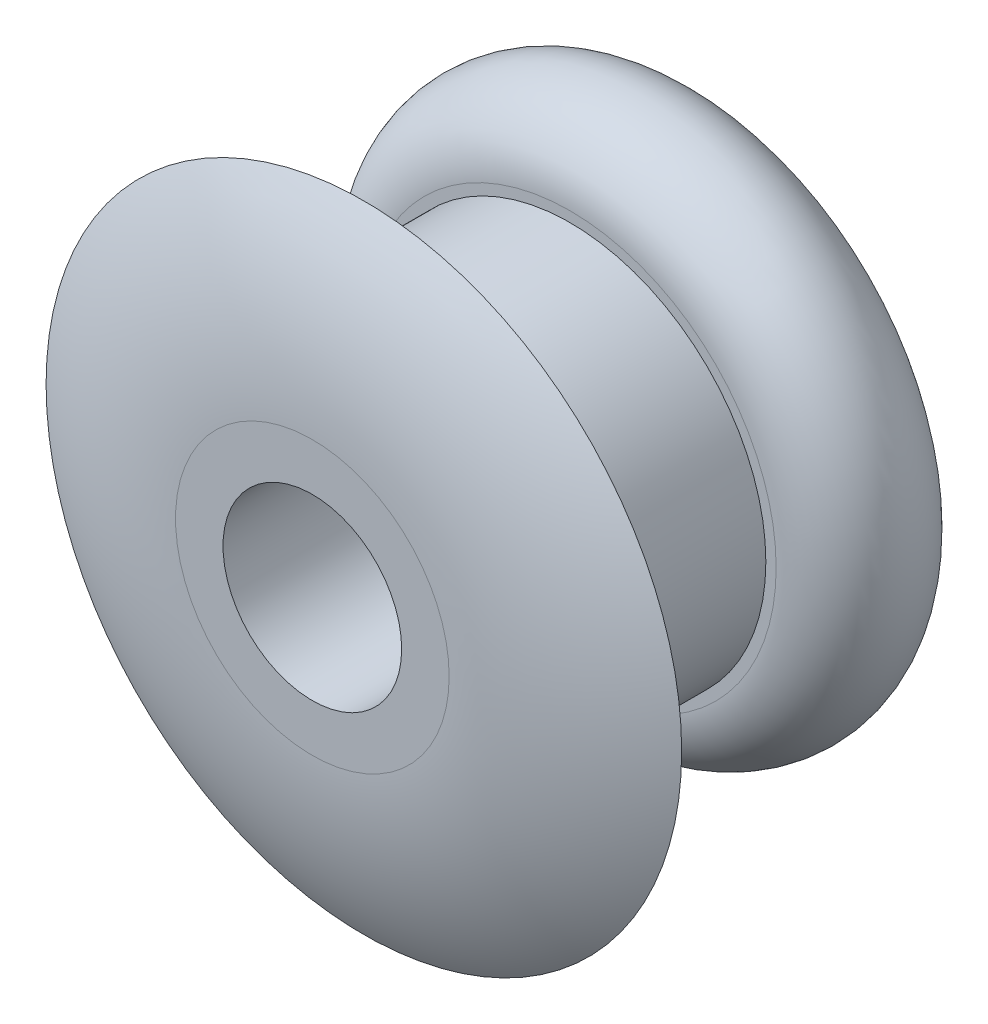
SolidWorks part; units mm, degrees
ref_plane "Face" through (0, 0, 0) normal (0, 0, 1) x (1, 0, 0)
ref_plane "Dessus" through (0, 0, 0) normal (0, 1, 0) x (1, 0, 0)
ref_plane "Droite" through (0, 0, 0) normal (1, 0, 0) x (0, 0, -1)
sketch "Esquisse1" plane through (0, 0, 0) normal (1, 0, 0) x (0, 0, -1)
  line L0 (-4.5394, 0) -> (9.1487, 0) construction
  line L1 (0, 1.3) -> (0, 1.9911)
  line L2 (5.75, 1.73) -> (4.5, 1.73)
  line L3 (0.75, 2.85) -> (0.75, 4.625)
  line L4 (0.75, 2.85) -> (3.75, 2.85)
  line L5 (4.5, 1.73) -> (4.5, 1.3)
  line L6 (5.75, 1.73) -> (5.75, 3)
  line L7 (4.5, 1.3) -> (0, 1.3)
  line L8 (3.75, 2.85) -> (3.75, 3)
  arc A0 (0, 1.9911) -> (0.75, 4.625) centre (5, 1.9911) cw
  arc A1 (5.75, 3) -> (3.75, 3) centre (4.75, 3) ccw
  dimension "D2" = 0.75
  dimension "D7" = 2
  dimension "D8" = 5
  dimension "D1" = 3.46
  dimension "D3" = 2.6
  dimension "D4" = 3
  dimension "D5" = 9.25
  dimension "D6" = 5.7
  dimension "D9" = 4.5
  dimension "D10" = 6
revolve "Base-Révolution" add sketch "Esquisse1" angle 360 about L0
